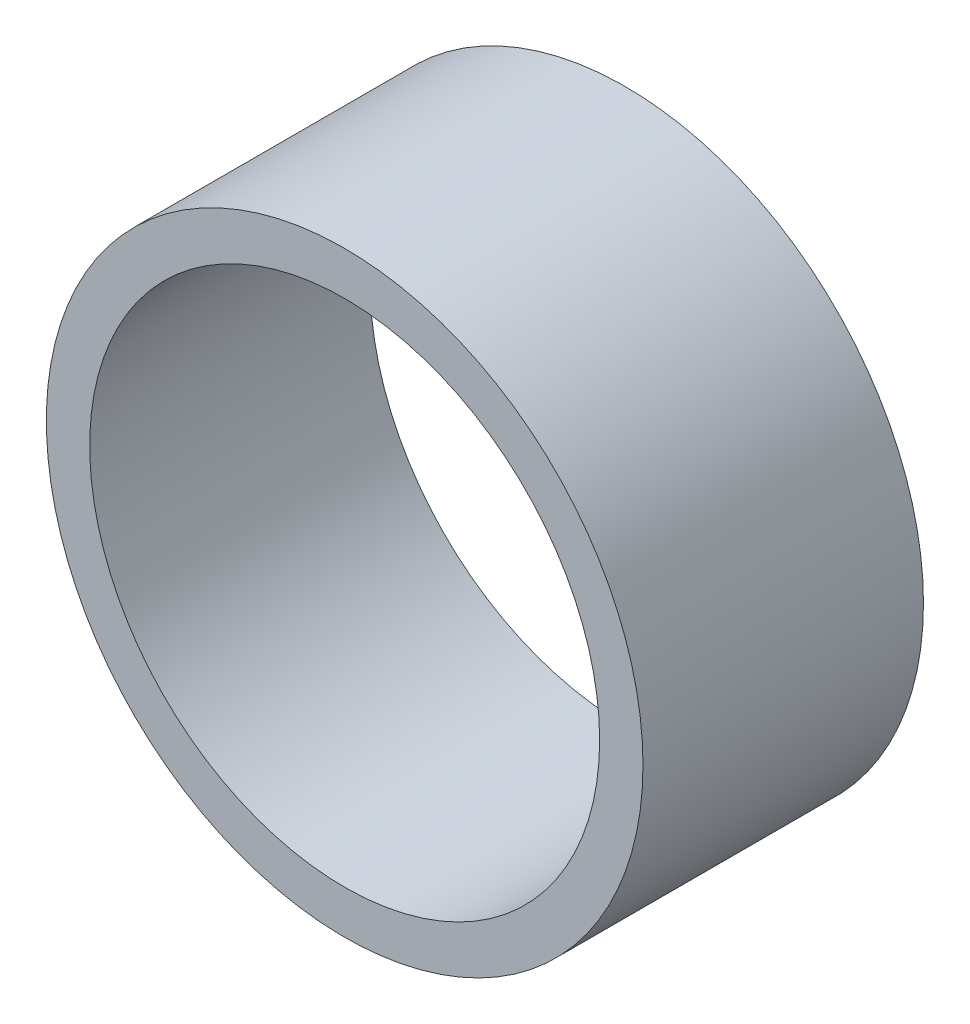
SolidWorks part; units mm, degrees
ref_plane "Face" through (0, 0, 0) normal (0, 0, 1) x (1, 0, 0)
ref_plane "Dessus" through (0, 0, 0) normal (0, 1, 0) x (1, 0, 0)
ref_plane "Droite" through (0, 0, 0) normal (1, 0, 0) x (0, 0, -1)
sketch "Esquisse1" plane through (0, 0, 0) normal (0, 0, 1) x (1, 0, 0)
  circle A0 centre (0, 0) radius 20
  circle A1 centre (0, 0) radius 23.4
extrude "Extrusion1" add sketch "Esquisse1" along normal blind 22
